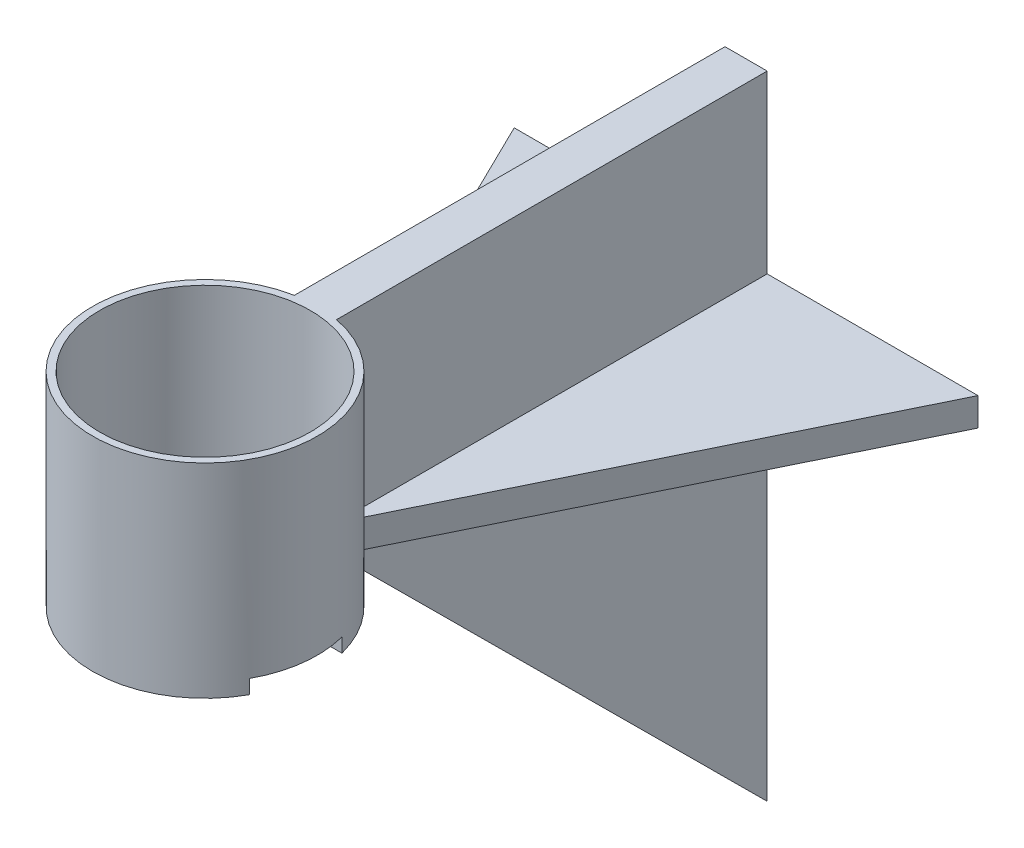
SolidWorks part; units mm, degrees
ref_plane "Front Plane" through (0, 0, 0) normal (0, 0, 1) x (1, 0, 0)
ref_plane "Top Plane" through (0, 0, 0) normal (0, 1, 0) x (1, 0, 0)
ref_plane "Right Plane" through (0, 0, 0) normal (1, 0, 0) x (0, 0, -1)
sketch "Sketch2" plane through (0, 0, 0) normal (0, 1, 0) x (1, 0, 0)
  circle A0 centre (0, 0) radius 20.32
  circle A1 centre (0, 0) radius 19.05
  dimension "D1" = 40.64
  dimension "D2" = 38.1
extrude "Boss-Extrude1" add sketch "Sketch2" against normal blind 35.56
sketch "Sketch3" plane through (0, -35.56, 0) normal (0, -1, 0) x (-1, 0, 0)
  circle A0 centre (0, 0) radius 20.32
extrude "Boss-Extrude2" add sketch "Sketch3" along normal blind 1.27
sketch "Sketch4" plane through (0, -36.83, 0) normal (0, -1, 0) x (-1, 0, 0)
  line L1 (14.5948, -5.08) -> (-14.6042, -5.08)
  line L2 (22.86, -1.1227) -> (22.86, 5.08)
  line L3 (22.86, 5.08) -> (-22.86, 5.08)
  line L4 (-22.86, -1.1151) -> (-22.86, 5.08)
  arc A0 (14.5948, -5.08) -> (22.86, -1.1227) centre (19.6748, -5.08) ccw
  circle A1 centre (0, 0) radius 20.32 construction
  arc A2 (-22.86, -1.1151) -> (-14.6042, -5.08) centre (-19.6842, -5.08) ccw
  dimension "D5" = 10.16
  dimension "D6" = 10.16
  dimension "D1" = 5.08
  dimension "D2" = 5.08
  dimension "D3" = 22.86
  dimension "D4" = 22.86
extrude "Cut-Extrude2" cut sketch "Sketch4" against normal blind 2.54
sketch "Sketch6" plane through (0, 0, 0) normal (0, 1, 0) x (1, 0, 0)
  line L0 (0, 19.05) -> (0, 97.79) construction
  line L1 (3.81, 19.05) -> (3.81, 97.79)
  line L2 (-3.81, 19.05) -> (-3.81, 97.79)
  line L3 (-3.81, 97.79) -> (3.81, 97.79)
  line L4 (-3.81, 19.05) -> (3.81, 19.05)
  arc A0 (18.3602, 5.08) -> (-18.3602, 5.08) centre (0, 0) ccw construction
  dimension "D1" = 78.74
  dimension "D2" = 3.81
  dimension "D3" = 3.81
extrude "Boss-Extrude3" add sketch "Sketch6" against normal blind 36.83
ref_plane "Plane1" through (0, 0, -59.69) normal (0, 0, -1) x (-1, 0, 0)
sketch "Sketch8" plane through (3.81, 0, 0) normal (1, 0, 0) x (0, 0, -1)
  line L0 (97.79, -36.83) -> (97.79, -114.3)
  line L1 (97.79, -114.3) -> (19.9596, -36.83)
  line L2 (19.9596, -36.83) -> (97.79, -36.83)
  dimension "D1" = 77.47
extrude "Boss-Extrude4" add sketch "Sketch8" against normal blind 7.62
sketch "Sketch10" plane through (0, -36.83, 0) normal (0, -1, 0) x (-1, 0, 0)
  line L0 (3.81, 19.9596) -> (41.91, 97.79)
  line L1 (41.91, 97.79) -> (3.81, 97.79)
  line L2 (3.81, 97.79) -> (-3.81, 97.79)
  line L3 (-3.81, 97.79) -> (-41.91, 97.79)
  line L4 (-41.91, 97.79) -> (-3.81, 19.9596)
  line L5 (-3.81, 19.9596) -> (3.81, 19.9596)
  dimension "D1" = 38.1
  dimension "D2" = 38.1
extrude "Boss-Extrude6" add sketch "Sketch10" against normal blind 5.08
ref_plane "Plane2" through (0, -114.3, 0) normal (0, -1, 0) x (-1, 0, 0)
sketch "Sketch11" plane through (0, -114.3, 0) normal (0, -1, 0) x (-1, 0, 0)
  line L0 (0, 97.79) -> (2.286, 97.79)
  line L1 (3.81, 97.79) -> (-3.81, 97.79) construction
  line L2 (2.286, 97.79) -> (2.286, 93.218)
  line L3 (2.286, 93.218) -> (-2.286, 93.218)
  line L4 (-2.286, 93.218) -> (-2.286, 97.79)
  line L5 (-2.286, 97.79) -> (0, 97.79)
  dimension "D1" = 2.286
  dimension "D2" = 2.286
  dimension "D3" = 4.572
extrude "Cut-Extrude3" cut sketch "Sketch11" against normal blind 76.2
